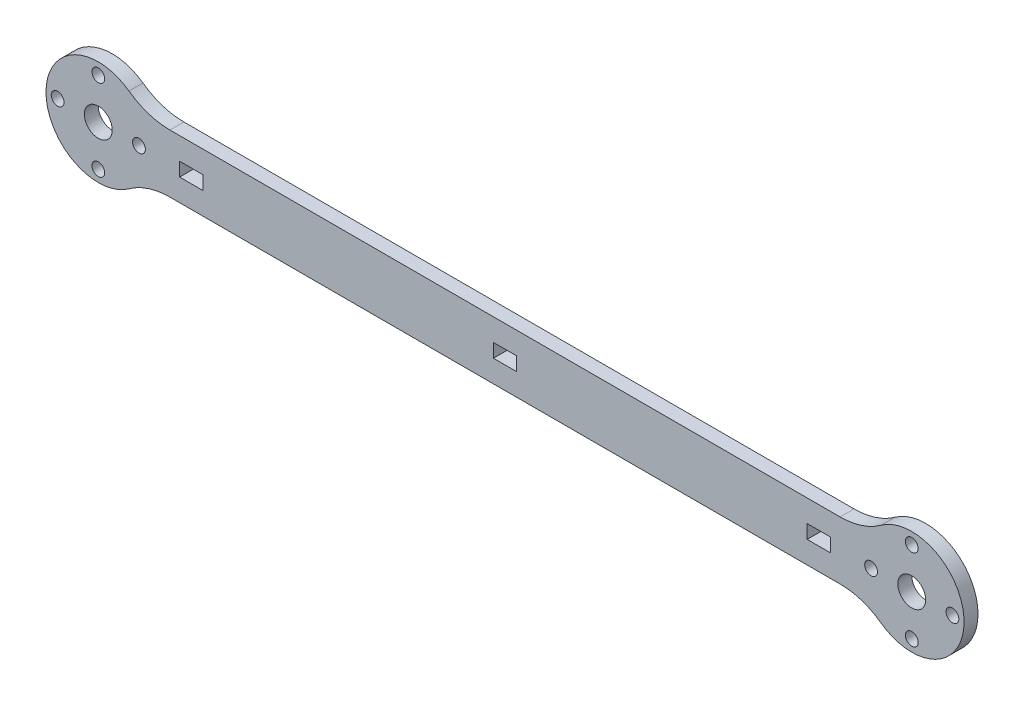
SolidWorks part; units mm, degrees
ref_plane "Front Plane" through (0, 0, 0) normal (0, 0, 1) x (1, 0, 0)
ref_plane "Top Plane" through (0, 0, 0) normal (0, 1, 0) x (1, 0, 0)
ref_plane "Right Plane" through (0, 0, 0) normal (1, 0, 0) x (0, 0, -1)
sketch "Sketch1" plane through (0, 0, 0) normal (0, 0, 1) x (1, 0, 0)
  line L0 (-1000, 0) -> (49000, 0) construction
  line L1 (-144.1779, 12.5) -> (-144.1779, -20.8891) construction
  line L2 (144.1779, 12.5) -> (144.1779, -32.6304) construction
  line L3 (130, 2.95) -> (130, -2.95)
  line L4 (-144.1779, 12.5) -> (144.1779, 12.5)
  line L5 (-169.8371, 21.8996) -> (169.8371, -21.8996) construction
  line L6 (-170.5297, -22.0515) -> (170.5297, 22.0515) construction
  line L7 (0, -1000) -> (0, 49000) construction
  line L8 (-175, 59.3482) -> (-175, -59.3482) construction
  line L9 (175, 59.3482) -> (175, -59.3482) construction
  line L10 (-140, 2.95) -> (140, 2.95) construction
  line L11 (-144.1779, -12.5) -> (144.1779, -12.5)
  line L12 (-140, 2.95) -> (-140, -2.95) construction
  line L13 (-156.2917, 12.5) -> (156.2917, -12.5) construction
  line L14 (-156.2917, -12.5) -> (156.2917, 12.5) construction
  line L15 (-140, -2.95) -> (140, -2.95) construction
  line L16 (140, 2.95) -> (140, -2.95) construction
  line L17 (-140, 2.95) -> (140, -2.95) construction
  line L18 (-140, -2.95) -> (140, 2.95) construction
  line L19 (-140, 2.95) -> (-130, 2.95)
  line L20 (-140, 2.95) -> (-140, -2.95)
  line L21 (-140, -2.95) -> (-130, -2.95)
  line L22 (-130, 2.95) -> (-130, -2.95)
  line L23 (-5, 2.95) -> (5, 2.95)
  line L24 (-5, 2.95) -> (-5, -2.95)
  line L25 (-5, -2.95) -> (5, -2.95)
  line L26 (5, 2.95) -> (5, -2.95)
  line L27 (-5, 2.95) -> (5, -2.95) construction
  line L28 (-5, -2.95) -> (5, 2.95) construction
  line L29 (140, -2.95) -> (130, -2.95)
  line L30 (140, 2.95) -> (140, -2.95)
  line L31 (140, 2.95) -> (130, 2.95)
  arc A0 (-161.7905, 18.2143) -> (-161.7905, -18.2143) centre (-175, 0) ccw
  circle A1 centre (-175, 0) radius 17.5 construction
  circle A2 centre (-175, 0) radius 6
  circle A3 centre (-175, 17.5) radius 2.75
  circle A4 centre (-157.5, 0) radius 2.75
  circle A5 centre (-175, -17.5) radius 2.75
  circle A6 centre (-192.5, 0) radius 2.75
  arc A7 (161.7905, 18.2143) -> (161.7905, -18.2143) centre (175, 0) cw
  circle A8 centre (175, 0) radius 17.5 construction
  circle A9 centre (175, -17.5) radius 2.75
  circle A10 centre (192.5, 0) radius 2.75
  circle A11 centre (157.5, 0) radius 2.75
  circle A12 centre (175, 17.5) radius 2.75
  circle A13 centre (175, 0) radius 6
  arc A14 (-161.7905, -18.2143) -> (-144.1779, -12.5) centre (-144.1779, -42.5) cw
  arc A15 (-144.1779, 12.5) -> (-161.7905, 18.2143) centre (-144.1779, 42.5) cw
  arc A16 (144.1779, -12.5) -> (161.7905, -18.2143) centre (144.1779, -42.5) cw
  arc A17 (144.1779, 12.5) -> (161.7905, 18.2143) centre (144.1779, 42.5) ccw
  point P0 (0, 0)
  point P1 (0, 0)
  point P18 (-175, 0)
  point P28 (-175, 0)
  point P56 (0, 0)
  point P64 (0, 0)
  dimension "D3" = 35
  dimension "D4" = 12
  dimension "D5" = 5.5
  dimension "D2" = 22.5
  dimension "D7" = 12
  dimension "D8" = 30
  dimension "D1" = 25
  dimension "D9" = 350
  dimension "D10" = 280
  dimension "D11" = 5.9
  dimension "D12" = 10
  dimension "D13" = 5.9
  dimension "D14" = 10
  dimension "D15" = 5.9
  dimension "D6" = 4
extrude "Boss-Extrude1" add sketch "Sketch1" along normal blind 6
